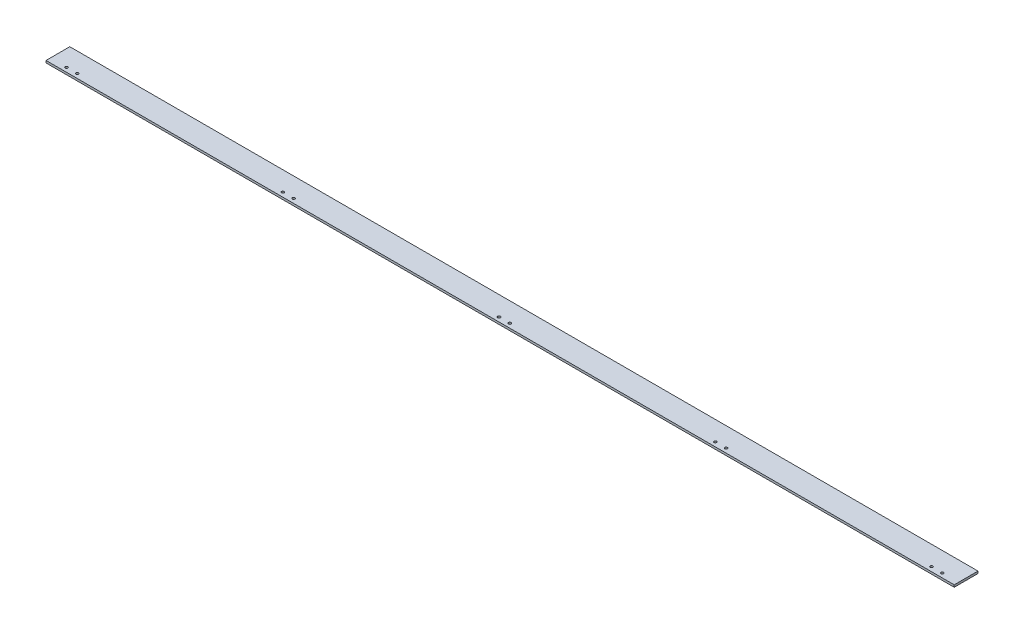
SolidWorks part; units mm, degrees
ref_plane "Plan de face" through (0, 0, 0) normal (0, 0, 1) x (1, 0, 0)
ref_plane "Plan de dessus" through (0, 0, 0) normal (0, 1, 0) x (1, 0, 0)
ref_plane "Plan de droite" through (0, 0, 0) normal (1, 0, 0) x (0, 0, -1)
sketch "Esquisse1" plane through (0, 0, 0) normal (0, 1, 0) x (1, 0, 0)
  line L1 (0, 0) -> (4200, 0)
  line L2 (0, 0) -> (0, 110)
  line L3 (0, 110) -> (4200, 110)
  line L4 (4200, 0) -> (4200, 110)
  dimension "D1" = 110
  dimension "D2" = 4200
extrude "Extrusion1" add sketch "Esquisse1" along normal blind 10
sketch "Esquisse2" plane through (0, 10, 0) normal (0, 1, 0) x (-1, 0, 0)
  line L0 (0, 0) -> (-4200, 0) construction
  line L1 (-4200, 0) -> (-4200, -110) construction
  circle A0 centre (-4125, -20) radius 6
  circle A1 centre (-4075, -20) radius 6
  circle A2 centre (-3125, -20) radius 6
  circle A3 centre (-3075, -20) radius 6
  circle A4 centre (-2125, -20) radius 6
  circle A5 centre (-2075, -20) radius 6
  circle A6 centre (-1125, -20) radius 6
  circle A7 centre (-1075, -20) radius 6
  circle A8 centre (-125, -20) radius 6
  circle A9 centre (-75, -20) radius 6
  dimension "D1" = 20
  dimension "D3" = 50
  dimension "D2" = 75
extrude "Enlèv. mat.-Extru.1" cut sketch "Esquisse2" against normal blind 10
